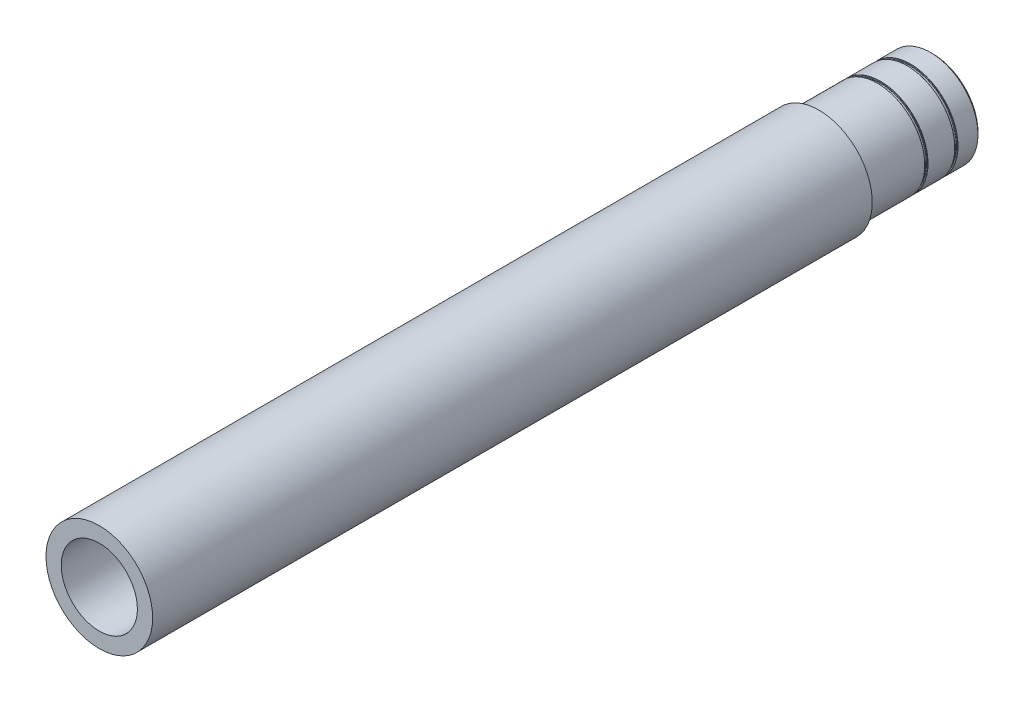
SolidWorks part; units mm, degrees
ref_plane "Front Plane" through (0, 0, 0) normal (0, 0, 1) x (1, 0, 0)
ref_plane "Top Plane" through (0, 0, 0) normal (0, 1, 0) x (1, 0, 0)
ref_plane "Right Plane" through (0, 0, 0) normal (1, 0, 0) x (0, 0, -1)
sketch "Sketch1" plane through (0, 0, 0) normal (0, 0, 1) x (1, 0, 0)
  circle A0 centre (0, 0) radius 44.45
  circle A1 centre (0, 0) radius 31.75
  dimension "D1" = 88.9
  dimension "D2" = 63.5
extrude "Boss-Extrude1" add sketch "Sketch1" along normal blind 700
sketch "Sketch2" plane through (0, 0, 0) normal (0, 0, -1) x (-1, 0, 0)
  circle A0 centre (0, 0) radius 39.6
  dimension "D1" = 79.2
extrude "Cut-Extrude1" cut sketch "Sketch2" against normal blind 100 flip side to cut
sketch "Sketch3" plane through (0, 0, 0) normal (1, 0, 0) x (0, 0, -1)
  line L0 (-51.1811, 40.8446) -> (-51.1811, 38.6094)
  line L1 (-51.1811, 40.8446) -> (-48.8189, 40.8446)
  line L2 (-50.9271, 38.3554) -> (-49.0729, 38.3554)
  line L3 (-48.8189, 40.8446) -> (-48.8189, 38.6094)
  line L4 (-51.1811, 40.8446) -> (-48.8189, 38.3554) construction
  line L5 (-51.1811, 38.3554) -> (-48.8189, 40.8446) construction
  line L6 (0, 39.6) -> (-100, 39.6) construction
  line L7 (-26.1811, 40.8446) -> (-26.1811, 38.6094)
  line L8 (-26.1811, 40.8446) -> (-23.8189, 40.8446)
  line L9 (-25.9271, 38.3554) -> (-24.0729, 38.3554)
  line L10 (-23.8189, 40.8446) -> (-23.8189, 38.6094)
  line L11 (-26.1811, 40.8446) -> (-23.8189, 38.3554) construction
  line L12 (-26.1811, 38.3554) -> (-23.8189, 40.8446) construction
  line L13 (-50, 39.6) -> (-25, 39.6) construction
  arc A0 (-48.8189, 38.6094) -> (-49.0729, 38.3554) centre (-49.0729, 38.6094) cw
  arc A1 (-51.1811, 38.6094) -> (-50.9271, 38.3554) centre (-50.9271, 38.6094) ccw
  arc A2 (-23.8189, 38.6094) -> (-24.0729, 38.3554) centre (-24.0729, 38.6094) cw
  arc A3 (-26.1811, 38.6094) -> (-25.9271, 38.3554) centre (-25.9271, 38.6094) ccw
  point P1 (-50, 39.6)
  point P14 (-25, 39.6)
  dimension "D3" = 0.254
  dimension "D1" = 2.4892
  dimension "D2" = 2.3622
  dimension "D5" = 25
  dimension "D4" = 2
ref_axis "Axis1" through (0, 0, 700) along (0, 0, -1)
revolve "Cut-Revolve1" cut sketch "Sketch3" angle 360 about axis through (0, 0, 700) along (0, 0, -1)
fillet "Fillet2" radius 0.1778 4 edges at (-39.6, 0, 26.1811) (39.6, 0, 23.8189) (39.6, 0, 48.8189) (-39.6, 0, 51.1811)
sketch "Sketch7" plane through (0, 0, 0) normal (0, 0, 1) x (1, 0, 0)
  circle A0 centre (0, 0) radius 44.45
extrude "Cut-Extrude3" cut sketch "Sketch7" along normal blind 5
chamfer "Chamfer1" distance 2 angle 45 1 edges at (39.6, 0, 5)
